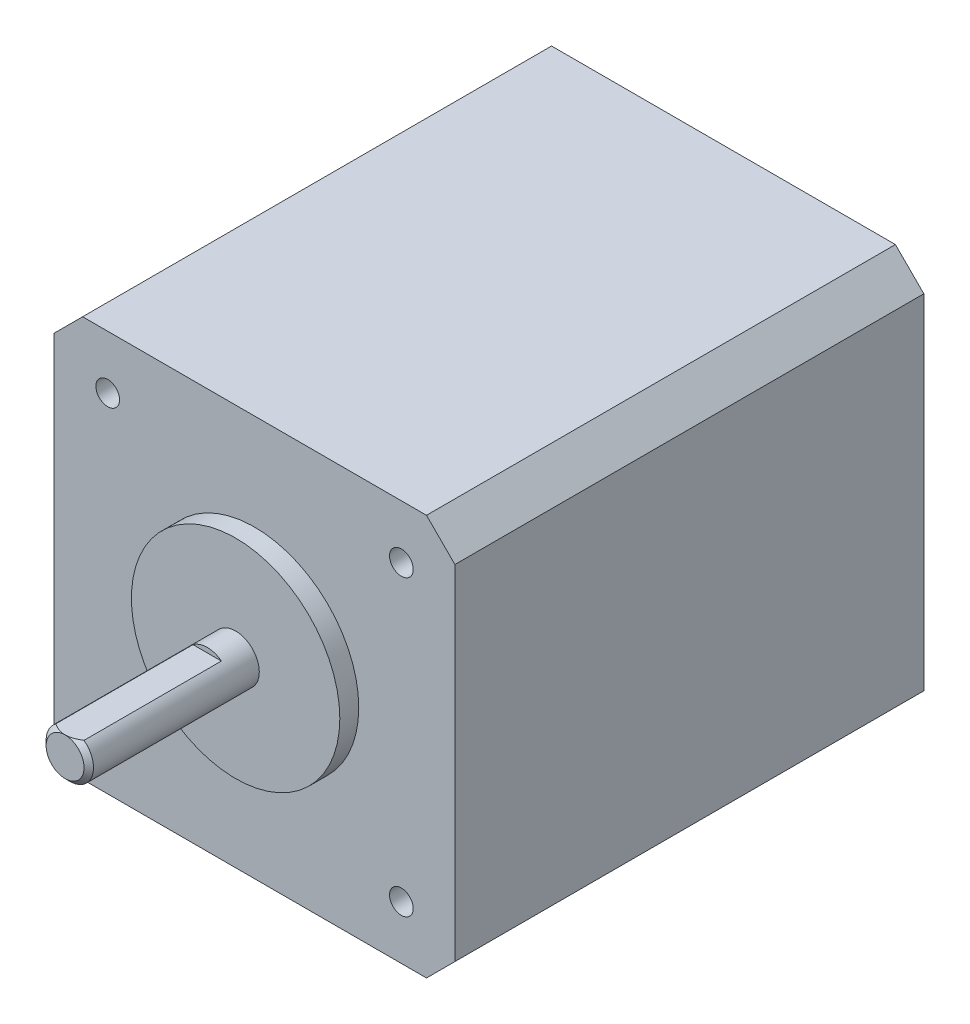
SolidWorks part; units mm, degrees
ref_plane "前视基准面" through (0, 0, 0) normal (0, 0, 1) x (1, 0, 0)
ref_plane "上视基准面" through (0, 0, 0) normal (0, 1, 0) x (1, 0, 0)
ref_plane "右视基准面" through (0, 0, 0) normal (1, 0, 0) x (0, 0, -1)
sketch "草图1" plane through (0, 0, 0) normal (0, 0, 1) x (1, 0, 0)
  circle A0 centre (0, 0) radius 11
extrude "凸台-拉伸1" add sketch "草图1" against normal blind 2
sketch "草图2" plane through (0, 0, 0) normal (0, 0, 1) x (1, 0, 0)
  circle A0 centre (0, 0) radius 2.5
extrude "凸台-拉伸2" add sketch "草图2" along normal blind 18
sketch "草图3" plane through (0, 0, 18) normal (0, 0, 1) x (1, 0, 0)
  line L1 (0, 2) -> (2.8558, 2)
  line L2 (2.8558, 2) -> (2.8558, 3.4127)
  line L3 (2.8558, 3.4127) -> (-2.5, 3.4127)
  line L4 (-2.5, 3.4127) -> (-2.5, 2)
  line L5 (-2.5, 2) -> (0, 2)
extrude "切除-拉伸1" cut sketch "草图3" against normal blind 15
chamfer "倒角1" distance 0.5 angle 45 1 edges at (0, -2.5, 18)
sketch "草图4" plane through (0, 0, -2) normal (0, 0, -1) x (-1, 0, 0)
  line L0 (-21.15, 18.15) -> (-18.15, 21.15)
  line L1 (0, 21.15) -> (18.15, 21.15)
  line L2 (21.15, 18.15) -> (21.15, -18.15)
  line L3 (18.15, -21.15) -> (-18.15, -21.15)
  line L4 (-21.15, -18.15) -> (-21.15, 18.15)
  line L5 (-18.15, 21.15) -> (0, 21.15)
  line L6 (18.15, 21.15) -> (21.15, 18.15)
  line L7 (21.15, -18.15) -> (18.15, -21.15)
  line L8 (-18.15, -21.15) -> (-21.15, -18.15)
  point P3 (21.15, 21.15)
  point P4 (21.15, -21.15)
  point P5 (-21.15, -21.15)
  point P6 (-21.15, 21.15)
extrude "凸台-拉伸3" add sketch "草图4" along normal blind 49.5
sketch "草图5" plane through (0, 0, -2) normal (0, 0, 1) x (1, 0, 0)
  point P8 (-15.5, 15.5)
  point P9 (15.5, 15.5)
  point P10 (15.5, -15.5)
  point P11 (-15.5, -15.5)
hole_wizard "M3 螺纹孔1" positions "草图7" profile "草图6" tap size "M3" standard "GB"
sketch "草图7" plane through (0, 0, -2) normal (0, 0, 1) x (1, 0, 0)
  point P0 (-15.5, 15.5)
  point P3 (15.5, 15.5)
  point P6 (15.5, -15.5)
  point P9 (-15.5, -15.5)
sketch "草图6" plane through (-15.5, 15.5, -2) normal (1, 0, 0) x (0, -1, 0)
  line L0 (0, 0) -> (0, 7.7511)
  line L1 (0, 7.7511) -> (1.25, 7)
  line L2 (1.25, 7) -> (1.25, 0)
  line L5 (1.25, 0) -> (0, 0)
  line L10 (0, 7.7511) -> (-1.25, 7) construction
  line L11 (0, -6.35) -> (0, 107.95) construction
  dimension "螺纹孔钻头直径" = 2.5
  dimension "螺纹孔钻头深度" = 7
  dimension "导头角度" = 118
